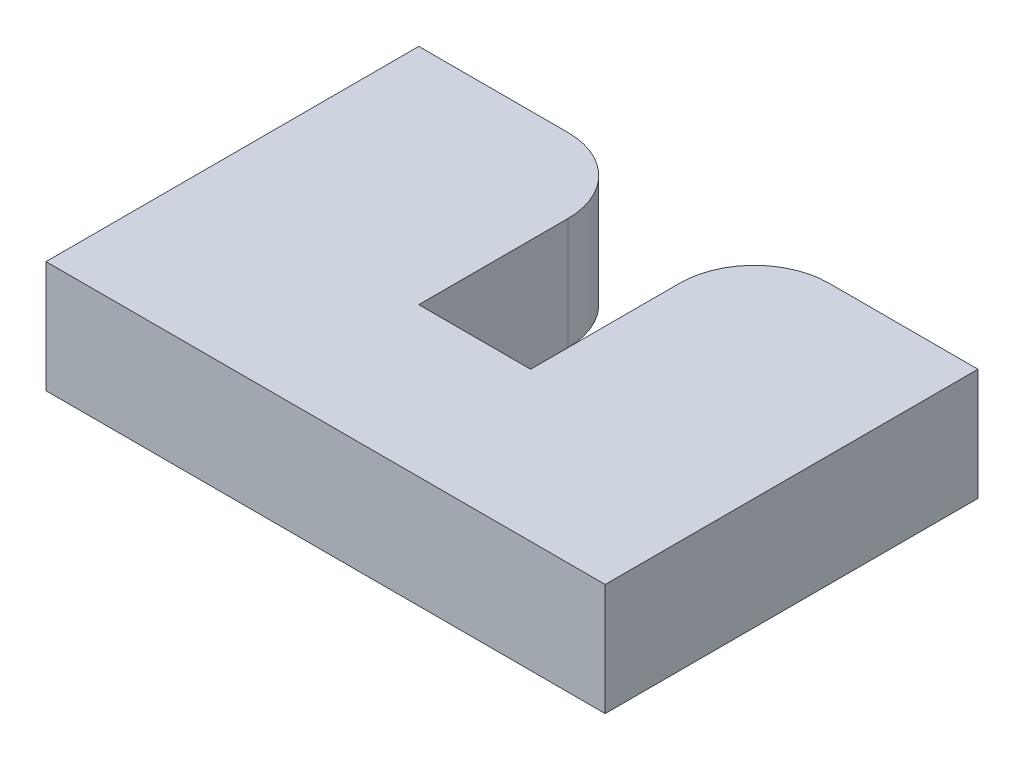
SolidWorks part; units mm, degrees
ref_plane "Front Plane" through (0, 0, 0) normal (0, 0, 1) x (1, 0, 0)
ref_plane "Top Plane" through (0, 0, 0) normal (0, 1, 0) x (1, 0, 0)
ref_plane "Right Plane" through (0, 0, 0) normal (1, 0, 0) x (0, 0, -1)
sketch "Sketch1" plane through (0, 0, 0) normal (0, 1, 0) x (1, 0, 0)
  line L0 (30, 40) -> (30, 20)
  line L1 (0, 0) -> (75, 0)
  line L2 (0, 0) -> (0, 50)
  line L3 (0, 50) -> (20, 50)
  line L4 (75, 0) -> (75, 50)
  line L5 (30, 20) -> (45, 20)
  line L6 (45, 20) -> (45, 40)
  line L7 (55, 50) -> (75, 50)
  arc A0 (45, 40) -> (55, 50) centre (55, 40) cw
  arc A1 (30, 40) -> (20, 50) centre (20, 40) ccw
  point P11 (45, 50)
  point P14 (30, 50)
  dimension "D5" = 10
  dimension "D1" = 15
  dimension "D2" = 30
  dimension "D3" = 30
  dimension "D4" = 20
extrude "Boss-Extrude1" add sketch "Sketch1" along normal blind 15
